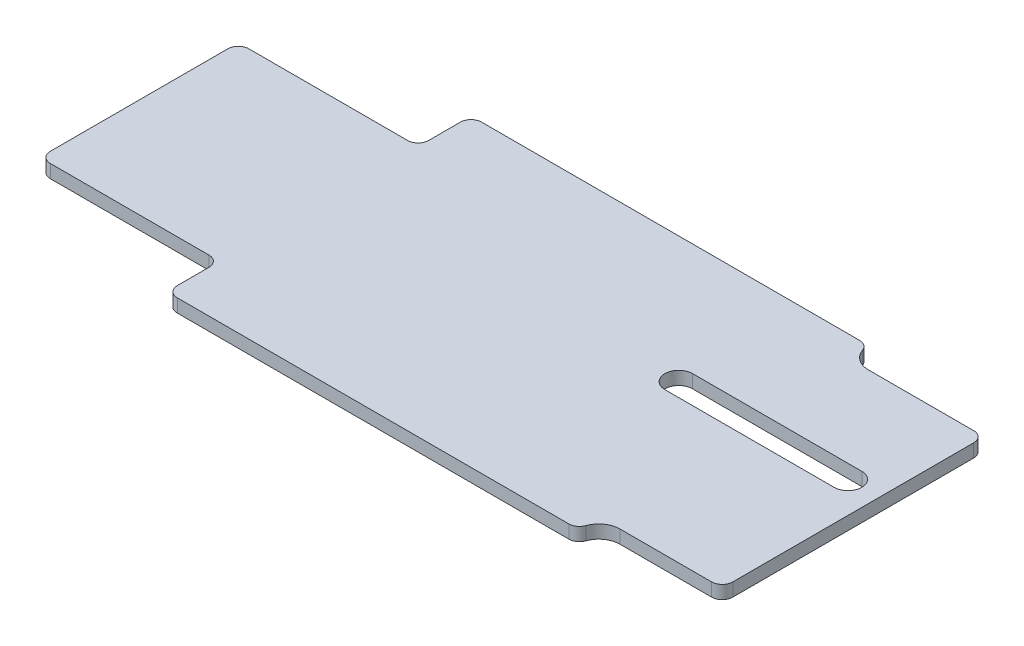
SolidWorks part; units mm, degrees
ref_plane "Front Plane" through (0, 0, 0) normal (0, 0, 1) x (1, 0, 0)
ref_plane "Top Plane" through (0, 0, 0) normal (0, 1, 0) x (1, 0, 0)
ref_plane "Right Plane" through (0, 0, 0) normal (1, 0, 0) x (0, 0, -1)
sketch "Sketch1" plane through (0, 0, 0) normal (0, 1, 0) x (1, 0, 0)
  line L0 (-87.6572, 32.3982) -> (-87.6572, -10.207)
  line L1 (-85.1172, -12.747) -> (-47.0172, -12.747)
  line L2 (-44.4772, -15.287) -> (-44.4772, -22.907)
  line L3 (-41.9372, -25.447) -> (52.1093, -25.447)
  line L9 (48.8442, 47.6382) -> (-41.9372, 47.6382)
  line L10 (-44.4772, 45.0982) -> (-44.4772, 37.4782)
  line L11 (-47.0172, 34.9382) -> (-85.1172, 34.9382)
  line L12 (56.0284, 42.5582) -> (81.3145, 42.5582)
  line L13 (83.8545, 40.0182) -> (83.8545, -17.827)
  line L14 (81.3145, -20.367) -> (59.2935, -20.367)
  line L15 (35.7084, 17.3387) -> (76.3484, 17.3387) construction
  line L18 (35.7084, 20.6704) -> (76.3484, 20.6704)
  line L21 (35.7084, 14.007) -> (76.3484, 14.007)
  arc A7 (81.3145, 42.5582) -> (83.8545, 40.0182) centre (81.3145, 40.0182) cw
  arc A8 (83.8545, -17.827) -> (81.3145, -20.367) centre (81.3145, -17.827) cw
  arc A10 (-44.4772, -22.907) -> (-41.9372, -25.447) centre (-41.9372, -22.907) ccw
  arc A11 (-47.0172, -12.747) -> (-44.4772, -15.287) centre (-47.0172, -15.287) cw
  arc A12 (-87.6572, -10.207) -> (-85.1172, -12.747) centre (-85.1172, -10.207) ccw
  arc A13 (-44.4772, 37.4782) -> (-47.0172, 34.9382) centre (-47.0172, 37.4782) cw
  arc A14 (-87.6572, 32.3982) -> (-85.1172, 34.9382) centre (-85.1172, 32.3982) cw
  arc A15 (-41.9372, 47.6382) -> (-44.4772, 45.0982) centre (-41.9372, 45.0982) ccw
  arc A16 (51.2389, 45.9449) -> (56.0284, 42.5582) centre (56.0284, 47.6382) ccw
  arc A17 (54.504, -23.7537) -> (59.2935, -20.367) centre (59.2935, -25.447) cw
  arc A18 (48.8442, 47.6382) -> (51.2389, 45.9449) centre (48.8442, 45.0982) cw
  arc A19 (52.1093, -25.447) -> (54.504, -23.7537) centre (52.1093, -22.907) ccw
  arc A20 (35.7084, 20.6704) -> (35.7084, 14.007) centre (35.7084, 17.3387) ccw
  arc A21 (76.3484, 14.007) -> (76.3484, 20.6704) centre (76.3484, 17.3387) ccw
  point P10 (-87.6572, 11.0956)
  point P16 (54.2135, -25.447)
  point P20 (56.0284, 17.3387)
  dimension "D9" = 2.54
  dimension "D2" = 5.08
  dimension "D5" = 2.54
  dimension "D3" = 6.6635
  dimension "D4" = 40.64
  dimension "D6" = 43.18
  dimension "D7" = 43.18
  dimension "D10" = 7.62
  dimension "D11" = 7.62
  dimension "D12" = 5.08
  dimension "D13" = 5.08
extrude "Boss-Extrude1" add sketch "Sketch1" along normal blind 3.175
